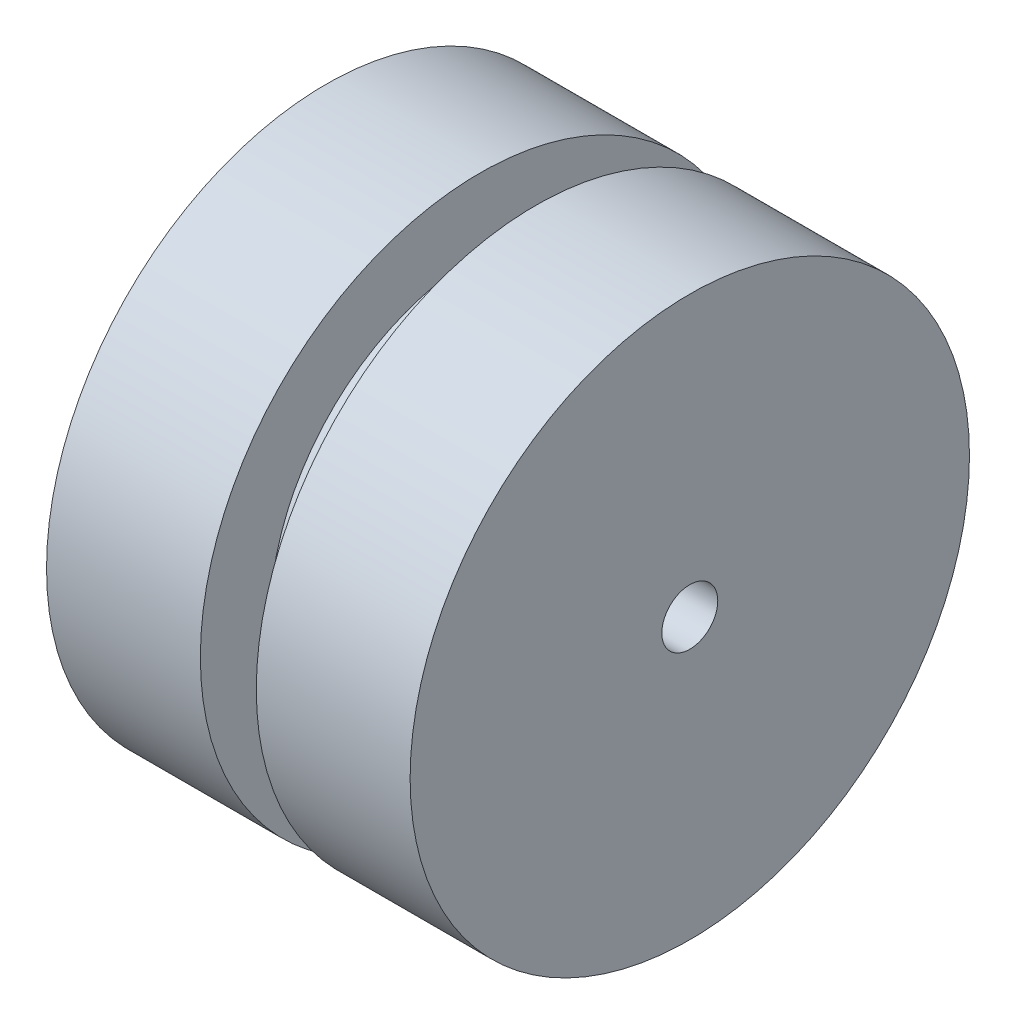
SolidWorks part; units mm, degrees
ref_plane "Front Plane" through (0, 0, 0) normal (0, 0, 1) x (1, 0, 0)
ref_plane "Top Plane" through (0, 0, 0) normal (0, 1, 0) x (1, 0, 0)
ref_plane "Right Plane" through (0, 0, 0) normal (1, 0, 0) x (0, 0, -1)
sketch "Sketch1" plane through (0, 0, 0) normal (0, 0, 1) x (1, 0, 0)
  line L0 (0, 0) -> (26, 0) construction
  line L1 (26, 0) -> (26, 20)
  line L2 (26, 20) -> (15, 20)
  line L3 (15, 20) -> (15, 15)
  line L4 (15, 15) -> (11, 15)
  line L5 (11, 15) -> (11, 20)
  line L6 (11, 20) -> (0, 20)
  line L7 (0, 20) -> (0, 0)
  line L8 (0, 0) -> (26, 0)
  dimension "D1" = 4
  dimension "D2" = 11
  dimension "D3" = 11
  dimension "D4" = 20
  dimension "D5" = 20
  dimension "D6" = 15
revolve "Revolve1" add sketch "Sketch1" angle 360 about L0
sketch "Sketch2" plane through (26, 0, 0) normal (1, 0, 0) x (0, 0, -1)
  circle A0 centre (0, 0) radius 2
  dimension "D1" = 4
extrude "Extrude1" cut sketch "Sketch2" against normal through all
